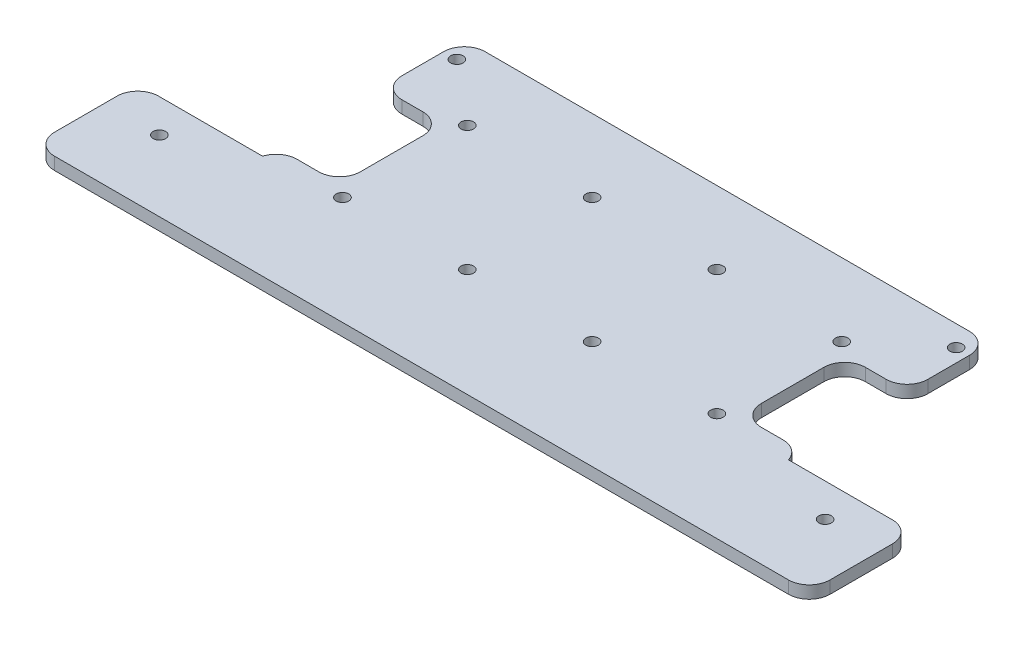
SolidWorks part; units mm, degrees
ref_plane "前视基准面" through (0, 0, 0) normal (0, 0, 1) x (1, 0, 0)
ref_plane "上视基准面" through (0, 0, 0) normal (0, 1, 0) x (1, 0, 0)
ref_plane "右视基准面" through (0, 0, 0) normal (1, 0, 0) x (0, 0, -1)
sketch "草图1" plane through (0, 0, 0) normal (0, 1, 0) x (1, 0, 0)
  line L1 (-53.2, 36.75) -> (53.2, 36.75)
  line L2 (-53.2, 36.75) -> (-53.2, -36.75)
  line L3 (-53.2, -36.75) -> (53.2, -36.75)
  line L4 (53.2, 36.75) -> (53.2, -36.75)
  line L5 (-53.2, 36.75) -> (53.2, -36.75) construction
  line L6 (-53.2, -36.75) -> (53.2, 36.75) construction
  point P0 (0, 0)
  dimension "D1" = 106.4
  dimension "D2" = 73.5
extrude "凸台-拉伸1" add sketch "草图1" along normal blind 3
sketch "草图3" plane through (0, 3, 0) normal (0, 1, 0) x (1, 0, 0)
  line L0 (0, 36.75) -> (0, -36.75) construction
  line L1 (53.2, 36.75) -> (-53.2, 36.75) construction
  line L2 (-53.2, -36.75) -> (53.2, -36.75) construction
  line L3 (63.2, 36.75) -> (63.2, -11.75)
  line L4 (-53.2, -36.75) -> (-93.2, -36.75)
  line L5 (-53.2, 36.75) -> (-63.2, 36.75)
  line L6 (-93.2, -36.75) -> (-93.2, -11.75)
  line L7 (-53.2, 36.75) -> (-53.2, -36.75)
  line L8 (-53.2, -36.75) -> (53.2, -36.75) construction
  line L9 (-63.2, 36.75) -> (-63.2, -11.75)
  line L11 (53.2, 36.75) -> (53.2, -36.75)
  line L12 (53.2, 36.75) -> (63.2, 36.75)
  line L13 (-93.2, -11.75) -> (-63.2, -11.75)
  line L14 (93.2, -11.75) -> (63.2, -11.75)
  line L15 (93.2, -36.75) -> (93.2, -11.75)
  line L16 (53.2, -36.75) -> (93.2, -36.75)
  circle A0 centre (-60, 31.75) radius 1.5
  circle A1 centre (-80, -19.75) radius 1.5
  circle A2 centre (80, -19.75) radius 1.5
  circle A3 centre (60, 31.75) radius 1.5
  dimension "D1" = 17
  dimension "D2" = 3
  dimension "D3" = 3
  dimension "D4" = 60
  dimension "D5" = 5
  dimension "D6" = 80
  dimension "D7" = 10
  dimension "D8" = 40
  dimension "D9" = 25
extrude "凸台-拉伸3" add sketch "草图3" against normal blind 3
sketch "草图4" plane through (0, 3, 0) normal (0, 1, 0) x (1, 0, 0)
  line L0 (0, 36.75) -> (0, -36.75) construction
  line L1 (63.2, 36.75) -> (-63.2, 36.75) construction
  line L2 (-93.2, -36.75) -> (93.2, -36.75) construction
  line L3 (63.2, 36.75) -> (-63.2, 36.75) construction
  line L4 (-63.2, 36.75) -> (-63.2, -11.75) construction
  line L6 (48.2, -8.25) -> (63.2, 16.75) construction
  line L7 (-48.2, 16.75) -> (-63.2, 16.75)
  line L8 (-48.2, 16.75) -> (-48.2, -8.25)
  line L9 (-48.2, -8.25) -> (-63.2, -8.25)
  line L10 (-63.2, 16.75) -> (-63.2, -8.25)
  line L11 (-48.2, 16.75) -> (-63.2, -8.25) construction
  line L12 (-48.2, -8.25) -> (-63.2, 16.75) construction
  line L13 (48.2, 16.75) -> (63.2, -8.25) construction
  line L14 (63.2, 16.75) -> (63.2, -8.25)
  line L15 (48.2, -8.25) -> (63.2, -8.25)
  line L16 (48.2, 16.75) -> (48.2, -8.25)
  line L17 (48.2, 16.75) -> (63.2, 16.75)
  point P12 (-55.7, 4.25)
  point P22 (55.7, 4.25)
  dimension "D1" = 15
  dimension "D2" = 25
  dimension "D3" = 20
extrude "切除-拉伸1" cut sketch "草图4" against normal blind 10
fillet "圆角1" radius 5 14 edges at (48.2, 1.5, -16.75) (63.2, 1.5, -16.75) (63.2, 1.5, -36.75) (48.2, 1.5, 8.25) (63.2, 1.5, 8.25) (-63.2, 1.5, -36.75) (-63.2, 1.5, -16.75) (-63.2, 1.5, 8.25) (-48.2, 1.5, 8.25) (-48.2, 1.5, -16.75) (-93.2, 1.5, 11.75) (93.2, 1.5, 11.75) (93.2, 1.5, 36.75) (-93.2, 1.5, 36.75)
sketch "草图5" plane through (0, 3, 0) normal (0, 1, 0) x (1, 0, 0)
  line L0 (0, 36.75) -> (0, -36.75) construction
  line L1 (58.2, 36.75) -> (-58.2, 36.75) construction
  line L2 (-88.2, -36.75) -> (88.2, -36.75) construction
  line L3 (-48.2, 4.25) -> (48.2, 4.25) construction
  line L4 (-48.2, -3.25) -> (-48.2, 11.75) construction
  line L5 (48.2, 11.75) -> (48.2, -3.25) construction
  circle A0 centre (-15, 19.25) radius 1.5
  circle A1 centre (15, 19.25) radius 1.5
  circle A2 centre (15, -10.75) radius 1.5
  circle A3 centre (-15, -10.75) radius 1.5
  circle A4 centre (-45, 19.25) radius 1.5
  circle A5 centre (45, 19.25) radius 1.5
  circle A6 centre (45, -10.75) radius 1.5
  circle A7 centre (-45, -10.75) radius 1.5
  dimension "D1" = 3
  dimension "D2" = 15
  dimension "D3" = 15
  dimension "D4" = 3
  dimension "D5" = 45
  dimension "D6" = 15
extrude "切除-拉伸2" cut sketch "草图5" against normal blind 10
